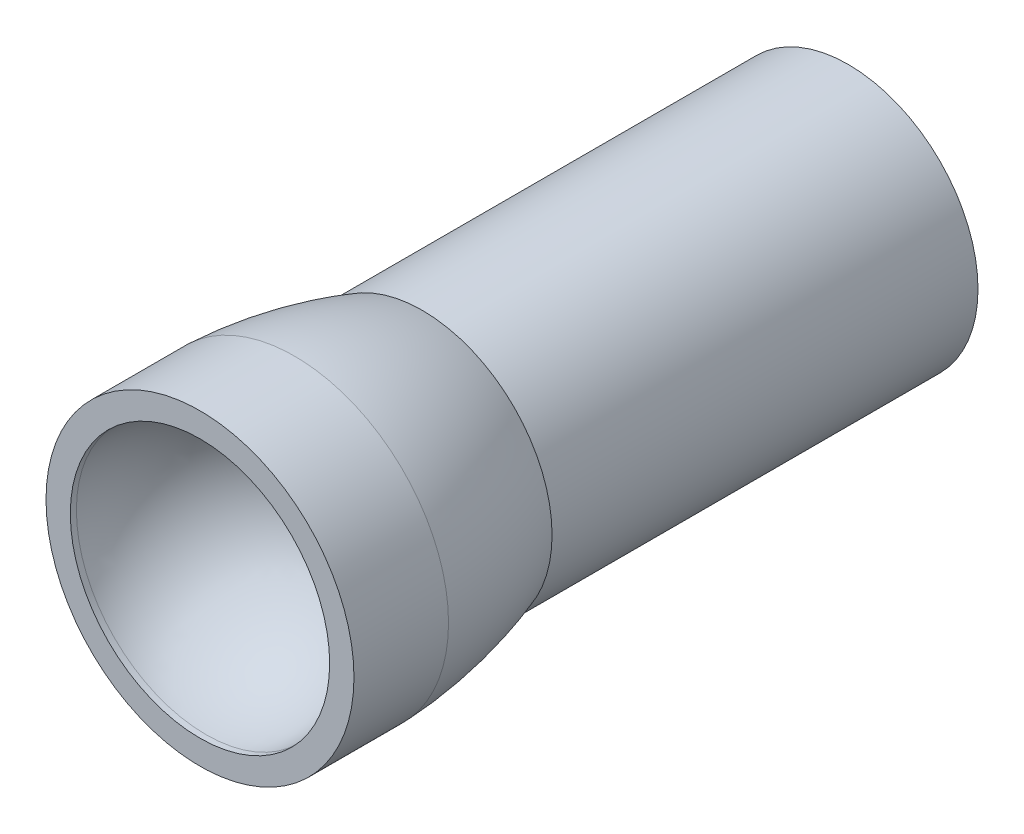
SolidWorks part; units mm, degrees
ref_plane "Face" through (0, 0, 0) normal (0, 0, 1) x (1, 0, 0)
ref_plane "Dessus" through (0, 0, 0) normal (0, 1, 0) x (1, 0, 0)
ref_plane "Droite" through (0, 0, 0) normal (1, 0, 0) x (0, 0, -1)
sketch "Esquisse1" plane through (0, 0, 0) normal (0, 0, 1) x (1, 0, 0)
  circle A0 centre (0, 0) radius 10
  dimension "D1" = 20
extrude "Extrusion1" add sketch "Esquisse1" along normal blind 40
sketch "Esquisse2" plane through (0, 0, 0) normal (0, 0, -1) x (-1, 0, 0)
  circle A0 centre (0, 0) radius 6.25
  dimension "D1" = 12.5
extrude "Enlèv. mat.-Extru.1" cut sketch "Esquisse2" against normal blind 25
sketch "Esquisse3" plane through (0, 0, 40) normal (0, 0, 1) x (1, 0, 0)
  circle A0 centre (0, 0) radius 2.4
  dimension "D1" = 4.8
extrude "Enlèv. mat.-Extru.2" cut sketch "Esquisse3" against normal through all
sketch "Esquisse5" plane through (0, 0, 0) normal (1, 0, 0) x (0, 0, -1)
  point P0 (-21, -2.4243)
sketch "Esquisse6" plane through (0, 0, 40) normal (0, 0, 1) x (1, 0, 0)
  circle A0 centre (0, 0) radius 8
  dimension "D1" = 16
extrude "Enlèv. mat.-Extru.3" cut sketch "Esquisse6" against normal blind 8
fillet "Congé3" radius 7.99 1 edges at (8, 0, 32)
sketch "Esquisse7" plane through (0, 0, 0) normal (1, 0, 0) x (0, 0, -1)
  line L0 (0, 0) -> (-37.2519, 0) construction
  line L1 (-7, 7) -> (-8.5, 7)
  line L2 (-7, 7) -> (-7, 0)
  line L3 (-7, 0) -> (-8.5, 0)
  line L4 (-8.5, 7) -> (-8.5, 0)
  dimension "D1" = 1.5
  dimension "D2" = 7
  dimension "D3" = 7
  dimension "D4" = 7
revolve "Enlèvement de matière-Révolution1" cut sketch "Esquisse7" angle 360 about L0
sketch "Esquisse8" plane through (0, 0, 0) normal (1, 0, 0) x (0, 0, -1)
  line L1 (0, -10) -> (0, 10) construction
  line L2 (0, -8) -> (-26.2788, -8)
  line L3 (-40, -9.5) -> (-34.1659, -9.5)
  line L4 (-40, 10) -> (-40, -10) construction
  line L5 (-47.3049, 0) -> (1.5971, 0) construction
  line L8 (0, -8) -> (0, 0)
  line L9 (0, 0) -> (2.3444, 0)
  line L10 (2.3444, 0) -> (2.3444, -12.086)
  line L11 (2.3444, -12.086) -> (-46.1524, -12.086)
  line L12 (-46.1524, -12.086) -> (-46.1524, 0)
  line L13 (-46.1524, 0) -> (-40, 0)
  line L14 (-40, 0) -> (-40, -9.5)
  arc A0 (-26.2788, -8) -> (-34.1659, -9.5) centre (-35.5141, 19.0743) cw
  dimension "D1" = 8
  dimension "D2" = 9.5
  dimension "D3" = 8
revolve "Enlèvement de matière-Révolution2" cut sketch "Esquisse8" angle 360 about L5
